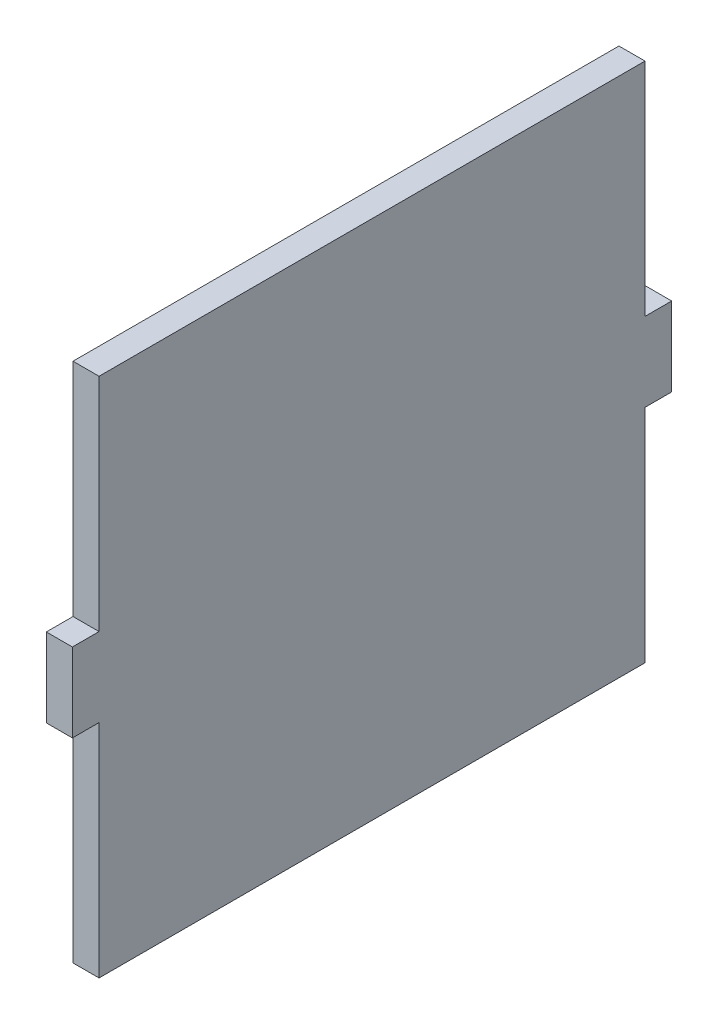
SolidWorks part; units mm, degrees
ref_plane "Front Plane" through (0, 0, 0) normal (0, 0, 1) x (1, 0, 0)
ref_plane "Top Plane" through (0, 0, 0) normal (0, 1, 0) x (1, 0, 0)
ref_plane "Right Plane" through (0, 0, 0) normal (1, 0, 0) x (0, 0, -1)
sketch "Sketch1" plane through (0, 0, 0) normal (1, 0, 0) x (0, 0, -1)
  line L0 (-84.4772, -46.6609) -> (145.5228, -46.6609) construction
  line L1 (-80.3372, 53.3191) -> (129.1828, 53.3191)
  line L2 (-80.3372, 53.3191) -> (-80.3372, -31.5409)
  line L3 (-80.3372, -146.6809) -> (129.1828, -146.6809)
  line L4 (129.1828, 53.3191) -> (129.1828, -31.5409)
  line L5 (-80.3372, -31.5409) -> (-90.5772, -31.5409)
  line L6 (-90.5772, -31.5409) -> (-90.5772, -61.7809)
  line L7 (-90.5772, -61.7809) -> (-80.3372, -61.7809)
  line L8 (24.4228, 53.3191) -> (24.4228, -146.6809) construction
  line L9 (139.4228, -61.7809) -> (129.1828, -61.7809)
  line L10 (139.4228, -31.5409) -> (139.4228, -61.7809)
  line L11 (129.1828, -31.5409) -> (139.4228, -31.5409)
  line L12 (-80.3372, -61.7809) -> (-80.3372, -146.6809)
  line L13 (129.1828, -61.7809) -> (129.1828, -146.6809)
  point P10 (-90.5772, -46.6609)
extrude "Boss-Extrude1" add sketch "Sketch1" along normal blind 10
equation "\"HeightHouse\" = \"SCALE\"*200mm"
equation "\"LenghtHouse\"=\"SCALE\"* 300mm"
equation "\"WidthHouse\"= \"SCALE\"*230mm"
equation "\"ThicknessMaterial\"=10mm"
equation "\"Kerf\"= 0.12mm"
equation "\"WidthWindows\"=\"SCALE\"* 45mm"
equation "\"WidthDoor\"=\"SCALE\"* 60mm"
equation "\"HeightDoor\"=\"SCALE\"* 80mm"
equation "\"LenghtJoints\" =\"SCALE\"* 30mm"
equation "\"HeightWindows\"=\"SCALE\"* 60"
equation "\"DistanceForJointsRoof\"=\"SCALE\"* 50mm"
equation "\"Roof1\"=\"SCALE\"* 115mm"
equation "\"Roof2\"=\"SCALE\"* 140mm"
equation "\"WidthWindowFrame\"=\"SCALE\"* 3mm"
equation "\"DistanceForJointsBody\"=\"SCALE\"* 35mm"
equation "\"CornerRoofBig\"=70deg"
equation "\"CornerRoofSmall\"= 60deg"
equation "\"LenghtRoof\"= \"LenghtHouse\"+(\"SCALE\"*40mm)"
equation "\"RoofSmall\"=\"SCALE\"* 120mm"
equation "\"RoofBig\"=\"SCALE\"* 170mm"
equation "\"D2@Sketch1\"=\"HeightHouse\""
equation "\"D4@Sketch1\"=\"LenghtJoints\"+\"Kerf\"*2"
equation "\"D3@Sketch1\"=\"ThicknessMaterial\"+\"Kerf\"*2"
equation "\"D1@Boss-Extrude1\"=\"ThicknessMaterial\""
equation "\"D1@Sketch1\"=\"WidthHouse\""
